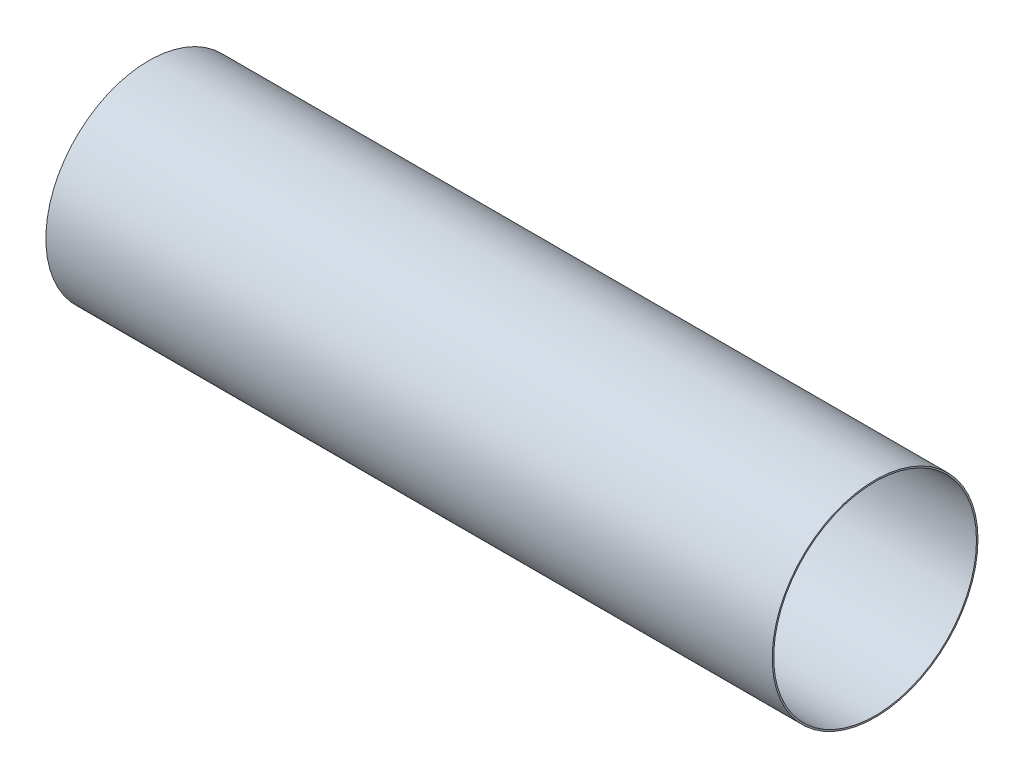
SolidWorks part; units mm, degrees
ref_plane "Front Plane" through (0, 0, 0) normal (0, 0, 1) x (1, 0, 0)
ref_plane "Top Plane" through (0, 0, 0) normal (0, 1, 0) x (1, 0, 0)
ref_plane "Right Plane" through (0, 0, 0) normal (1, 0, 0) x (0, 0, -1)
sketch "Sketch1" plane through (0, 0, 0) normal (1, 0, 0) x (0, 0, -1)
  circle A0 centre (0, 0) radius 16.75
  circle A1 centre (0, 0) radius 17
  dimension "D1" = 34
  dimension "D2" = 33.5
extrude "Extrude1" add sketch "Sketch1" along normal blind 120
